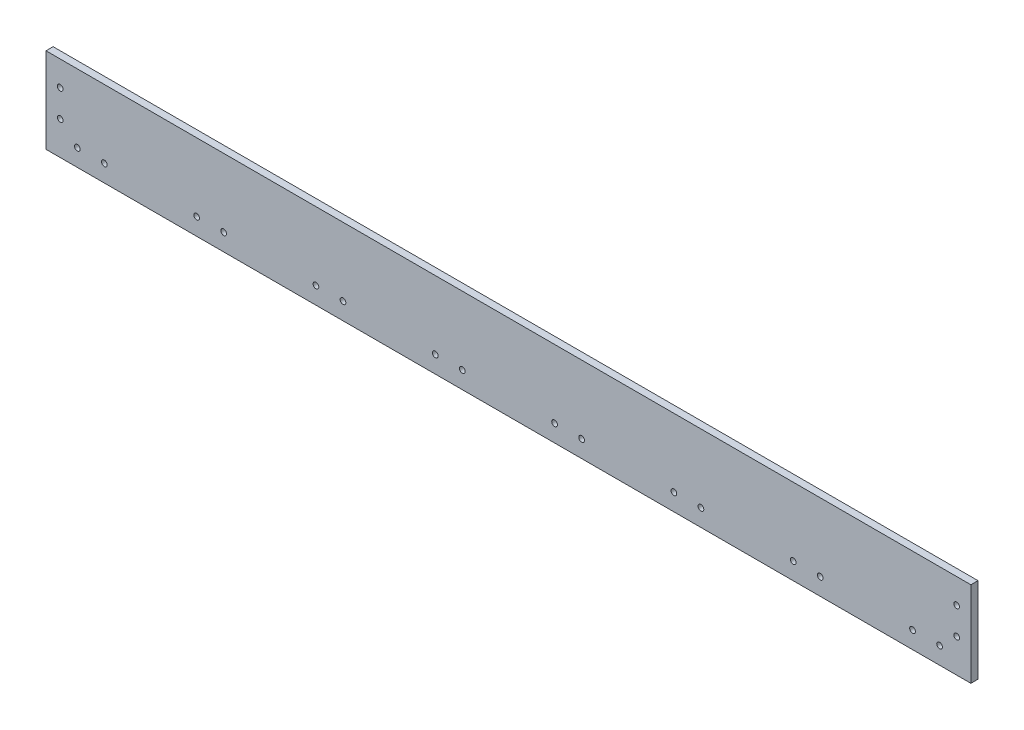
SolidWorks part; units mm, degrees
ref_plane "Front Plane" through (0, 0, 0) normal (0, 0, 1) x (1, 0, 0)
ref_plane "Top Plane" through (0, 0, 0) normal (0, 1, 0) x (1, 0, 0)
ref_plane "Right Plane" through (0, 0, 0) normal (1, 0, 0) x (0, 0, -1)
sketch "Sketch1" plane through (0, 0, 0) normal (0, 0, 1) x (1, 0, 0)
  line L1 (0, 0) -> (825.5, 0)
  line L2 (0, 0) -> (0, 76.2)
  line L3 (0, 76.2) -> (825.5, 76.2)
  line L4 (825.5, 0) -> (825.5, 76.2)
extrude "Boss-Extrude1" add sketch "Sketch1" along normal blind 6.35
sketch "Sketch2" plane through (0, 0, 6.35) normal (0, 0, 1) x (1, 0, 0)
  line L0 (27.94, 0) -> (27.94, 12.7) construction
  line L2 (0, 15.24) -> (25.4, 15.24) construction
  line L3 (0, 76.2) -> (0, 0) construction
  line L4 (0, 0) -> (825.5, 0) construction
  line L5 (30.48, 15.24) -> (49.53, 15.24) construction
  circle A0 centre (27.94, 15.24) radius 2.54
  circle A1 centre (52.07, 15.24) radius 2.54
  point P13 (1219.2, 76.2)
extrude "Cut-Extrude1" cut sketch "Sketch2" against normal up to surface (6.35 mm away) contours A1 | A0
sketch "Sketch3" plane through (0, 0, 6.35) normal (0, 0, 1) x (1, 0, 0)
  line L0 (0, 76.2) -> (0, 0) construction
  line L1 (825.5, 76.2) -> (0, 76.2) construction
  line L2 (12.7, 41.91) -> (0, 41.91) construction
  line L3 (12.7, 51.435) -> (12.7, 32.385) construction
  line L4 (0, 41.91) -> (0, 38.1) construction
  line L5 (412.75, 76.2) -> (412.75, 0) construction
  line L6 (0, 0) -> (825.5, 0) construction
  circle A0 centre (12.7, 29.845) radius 2.54
  circle A1 centre (12.7, 53.975) radius 2.54
  circle A2 centre (812.8, 29.845) radius 2.54
  circle A3 centre (812.8, 53.975) radius 2.54
  point P13 (0, 38.1)
  point P15 (412.75, 76.2)
  point P17 (12.7, 41.91)
  point P27 (12.7, 41.91)
extrude "Cut-Extrude2" cut sketch "Sketch3" against normal up to surface (6.35 mm away)
pattern_linear "LPattern2" count 8 spacing 106.4986 along (1, 0, 0) of "Cut-Extrude1"
equation "\"vertical-component-width\"= \"railing-width\" - \"railing-padding\""
equation "\"vertical-component-height\"= 3in"
equation "\"material-thickness\"= .25in"
equation "\"D1@Sketch1\"=\"vertical-component-height\""
equation "\"D2@Sketch1\"=\"vertical-component-width\""
equation "\"D1@Boss-Extrude1\"=\"material-thickness\""
equation "\"mounting-hole-diameter\"= .2"
equation "\"mounting-hole-pair-left-to-mount-edge-left\"= 1in"
equation "\"mounting-hole-bottom-to-mount-edge-bottom\"= .5in"
equation "\"mounting-hole-pair-distance-between-holes\"= .75in"
equation "\"distance-between-mounting-hole-pairs\"= ( \"vertical-component-width\" - 2 * \"mounting-hole-pair-left-to-mount-edge-left\" - \"num-mounting-hole-pairs\" * ( 2 * \"mounting-hole-diameter\" + \"mounting-hole-pa"
equation "\"num-mounting-hole-pairs\"= 8"
equation "\"D3@Sketch2\"=\"mounting-hole-pair-distance-between-holes\""
equation "\"D5@Sketch2\"=\"mounting-hole-bottom-to-mount-edge-bottom\""
equation "\"D4@Sketch2\"=\"mounting-hole-pair-left-to-mount-edge-left\""
equation "\"D3@LPattern2\"=\"mounting-hole-pair-left-to-next-mounting-hole-pair-left\""
equation "\"D2@Sketch2\"=\"mounting-hole-diameter\""
equation "\"D1@Sketch2\"=\"mounting-hole-diameter\""
equation "\"mounting-hole-pair-left-to-next-mounting-hole-pair-left\"= \"distance-between-mounting-hole-pairs\" + 2 * \"mounting-hole-diameter\" + \"mounting-hole-pair-distance-between-holes\""
equation "\"edge-mounting-hole-pair-inset\"=0.5"
equation "\"D4@Sketch3\"=\"edge-mounting-hole-pair-inset\""
equation "\"edge-mounting-hole-pair-offset-from-mount-vertical-center\"= 0.15"
equation "\"D5@Sketch3\"=\"edge-mounting-hole-pair-offset-from-mount-vertical-center\""
equation "\"D3@Sketch3\"=\"mounting-hole-pair-distance-between-holes\""
equation "\"railing-width\"= 33in"
equation "\"railing-padding\"= .5in"
equation "\"D1@LPattern2\"=\"num-mounting-hole-pairs\""
